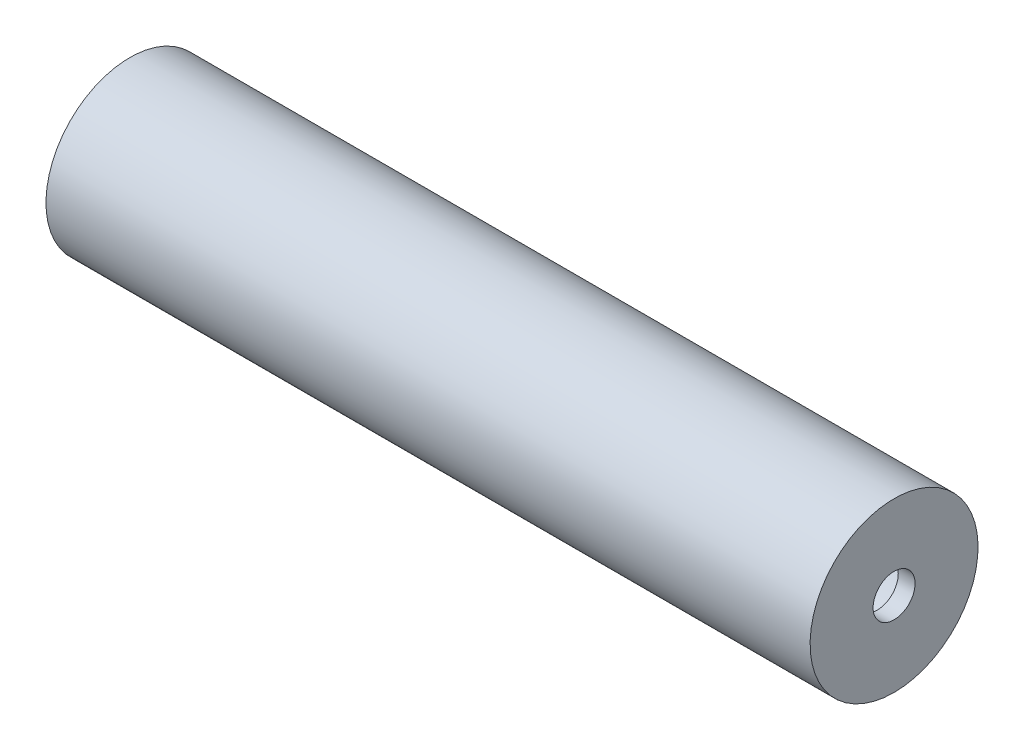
SolidWorks part; units mm, degrees
ref_plane "Plan de face" through (0, 0, 0) normal (0, 0, 1) x (1, 0, 0)
ref_plane "Plan de dessus" through (0, 0, 0) normal (0, 1, 0) x (1, 0, 0)
ref_plane "Plan de droite" through (0, 0, 0) normal (1, 0, 0) x (0, 0, -1)
sketch "Esquisse1" plane through (0, 0, 0) normal (0, 0, 1) x (1, 0, 0)
  line L0 (-45.5, 0) -> (45.5, 0) construction
  line L1 (-45.5, 2.5) -> (-45.5, 10)
  line L2 (-45.5, 10) -> (45.5, 10)
  line L3 (45.5, 10) -> (45.5, 2.5)
  line L4 (-43.5, 2.5) -> (-43.5, 8)
  line L5 (-43.5, 8) -> (43.5, 8)
  line L6 (43.5, 8) -> (43.5, 2.5)
  line L7 (-45.5, 2.5) -> (-43.5, 2.5)
  line L8 (43.5, 2.5) -> (45.5, 2.5)
  line L9 (-45.5, 0) -> (-45.5, 10) construction
  line L10 (-43.5, 0) -> (-43.5, 8) construction
  line L12 (43.5, 8) -> (43.5, 0) construction
  line L13 (45.5, 10) -> (45.5, 0) construction
  point P4 (0, 0)
  dimension "D1" = 91
  dimension "D2" = 10
  dimension "D4" = 2.5
  dimension "D3" = 2
revolve "Révolution1" add sketch "Esquisse1" angle 360 about L0
